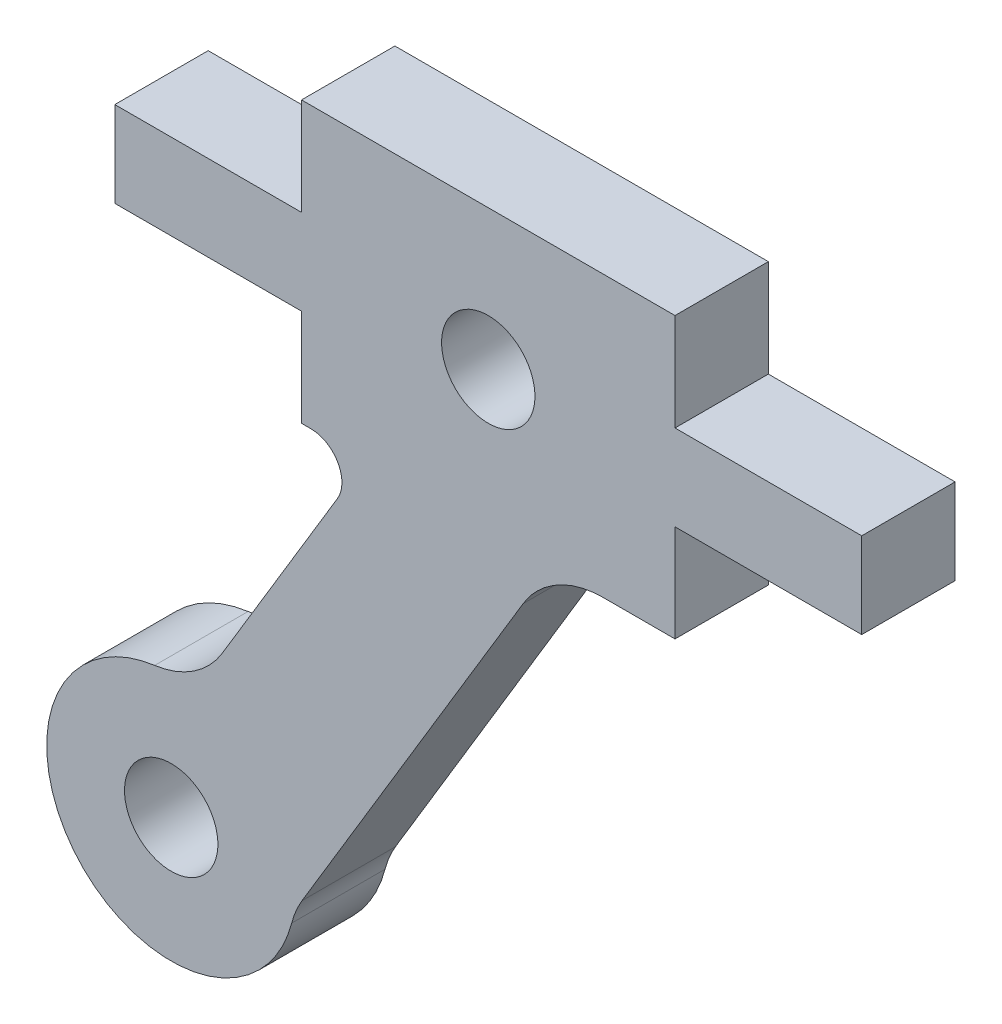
SolidWorks part; units mm, degrees
ref_plane "Front Plane" through (0, 0, 0) normal (0, 0, 1) x (1, 0, 0)
ref_plane "Top Plane" through (0, 0, 0) normal (0, 1, 0) x (1, 0, 0)
ref_plane "Right Plane" through (0, 0, 0) normal (1, 0, 0) x (0, 0, -1)
imported_body "Imported1"
sketch "Sketch1" plane through (0, 0, 0) normal (0, 0, 1) x (1, 0, 0)
  line L1 (-4.9432, -3.4355) -> (-11.545, -3.4355)
  line L2 (-4.9432, -3.4355) -> (-4.9432, -0.315)
  line L3 (-4.9432, -0.315) -> (-11.545, -0.315)
  line L4 (-11.545, -3.4355) -> (-11.545, -0.315)
  line L5 (-4.9432, 5.5645) -> (-11.809, 5.5645)
  line L6 (-4.9432, 5.5645) -> (-4.9432, 2.435)
  line L7 (-4.9432, 2.435) -> (-11.809, 2.435)
  line L8 (-11.809, 5.5645) -> (-11.809, 2.435)
  line L9 (7.0568, 5.5645) -> (13.7144, 5.5645)
  line L10 (7.0568, 5.5645) -> (7.0568, 2.435)
  line L11 (7.0568, 2.435) -> (13.7144, 2.435)
  line L12 (13.7144, 5.5645) -> (13.7144, 2.435)
  line L13 (7.0568, -3.4355) -> (14.0224, -3.4355)
  line L14 (7.0568, -3.4355) -> (7.0568, -0.315)
  line L15 (7.0568, -0.315) -> (14.0224, -0.315)
  line L16 (14.0224, -3.4355) -> (14.0224, -0.315)
extrude "Cut-Extrude1" cut sketch "Sketch1" against normal blind 3
